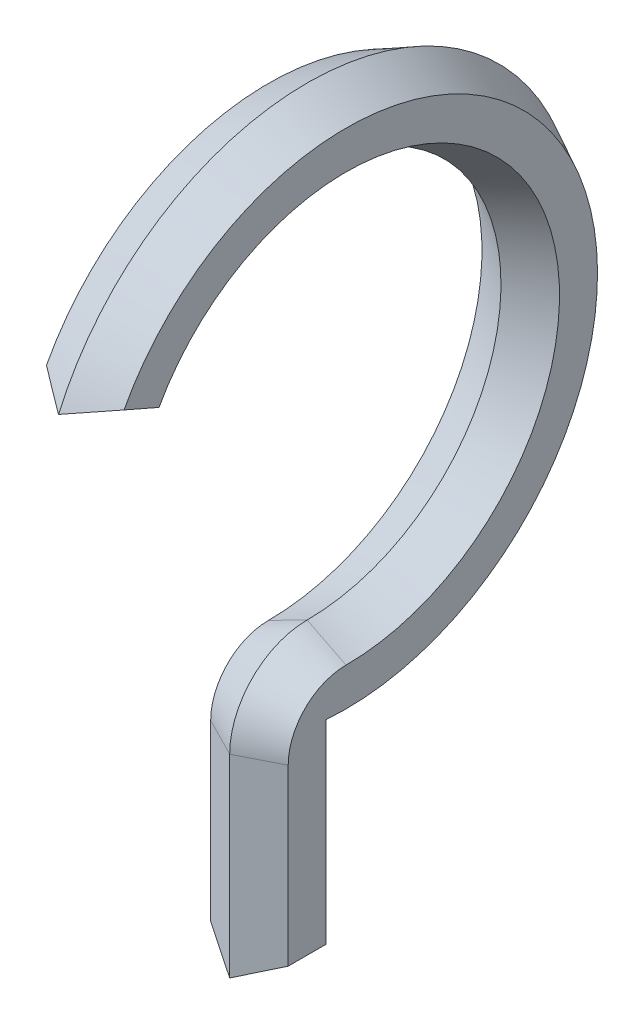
SolidWorks part; units mm, degrees
ref_plane "Front Plane" through (0, 0, 0) normal (0, 0, 1) x (1, 0, 0)
ref_plane "Top Plane" through (0, 0, 0) normal (0, 1, 0) x (1, 0, 0)
ref_plane "Right Plane" through (0, 0, 0) normal (1, 0, 0) x (0, 0, -1)
sketch "Sketch1" plane through (0, 0, 0) normal (1, 0, 0) x (0, 0, -1)
  line L0 (0, 0) -> (0, 25)
  arc A0 (0, 25) -> (10, 35) centre (10, 25) cw
  arc A1 (10, 35) -> (-12.9129, 70) centre (10, 60) ccw
  dimension "D2" = 10
  dimension "D3" = 25
  dimension "D1" = 25
  dimension "D4" = 60
  dimension "D5" = 70
extrude "Extrude-Thin1" add sketch "Sketch1" along normal mid plane 10 draft 27 thin
